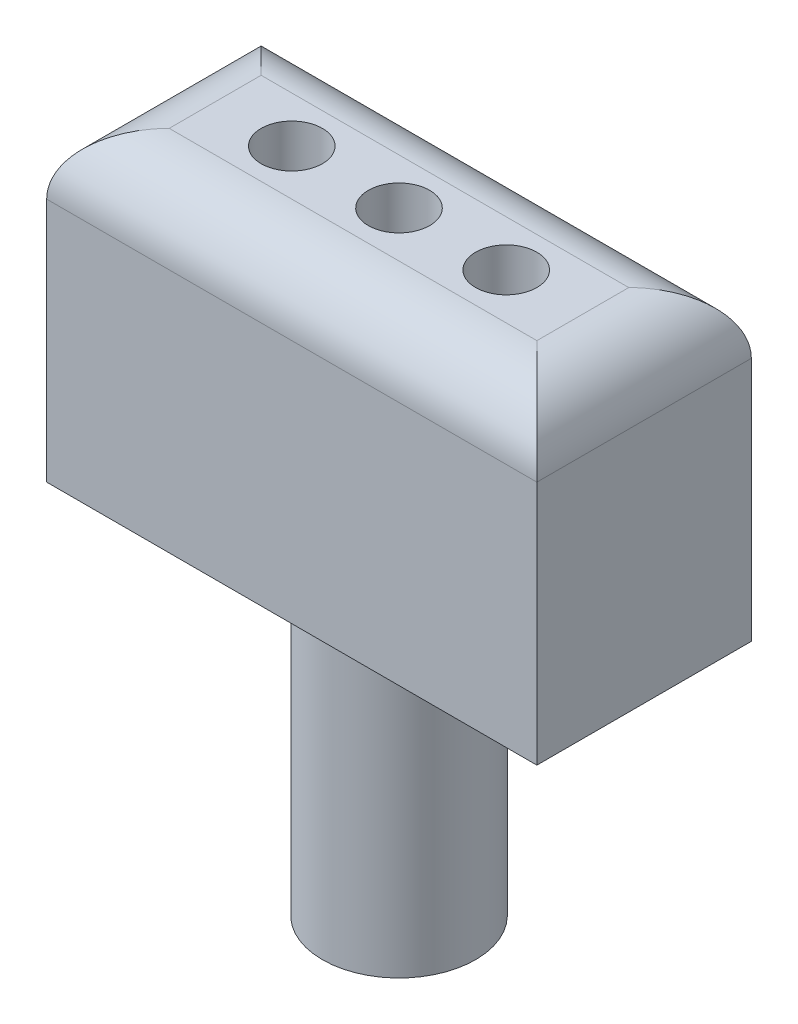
SolidWorks part; units mm, degrees
ref_plane "Front Plane" through (0, 0, 0) normal (0, 0, 1) x (1, 0, 0)
ref_plane "Top Plane" through (0, 0, 0) normal (0, 1, 0) x (1, 0, 0)
ref_plane "Right Plane" through (0, 0, 0) normal (1, 0, 0) x (0, 0, -1)
sketch "Sketch1" plane through (0, 0, 0) normal (0, 1, 0) x (1, 0, 0)
  circle A0 centre (0, 0) radius 12.5
  dimension "D1" = 25
extrude "Boss-Extrude1" add sketch "Sketch1" along normal blind 50
sketch "Sketch2" plane through (0, 50, 0) normal (0, 1, 0) x (1, 0, 0)
  line L1 (-40, 17.5) -> (40, 17.5)
  line L2 (-40, 17.5) -> (-40, -17.5)
  line L3 (-40, -17.5) -> (40, -17.5)
  line L4 (40, 17.5) -> (40, -17.5)
  line L5 (-40, 17.5) -> (40, -17.5) construction
  line L6 (-40, -17.5) -> (40, 17.5) construction
  point P0 (0, 0)
  dimension "D1" = 80
  dimension "D2" = 35
extrude "Boss-Extrude2" add sketch "Sketch2" along normal blind 50
fillet "Fillet1" radius 10 4 edges at (0, 100, 17.5) (-40, 100, 0) (0, 100, -17.5) (40, 100, 0)
sketch "Sketch3" plane through (0, 100, 0) normal (0, 1, 0) x (1, 0, 0)
  line L0 (30, 0) -> (-30, 0) construction
  line L1 (-30, 7.5) -> (-30, -7.5) construction
  line L3 (0, -19.25) -> (0, 19.25) construction
  circle A0 centre (0, 0) radius 5
  circle A1 centre (-17.5, 0) radius 5
  circle A2 centre (17.5, 0) radius 5
  point P8 (0, 0)
  dimension "D1" = 10
extrude "Cut-Extrude1" cut sketch "Sketch3" against normal blind 10
